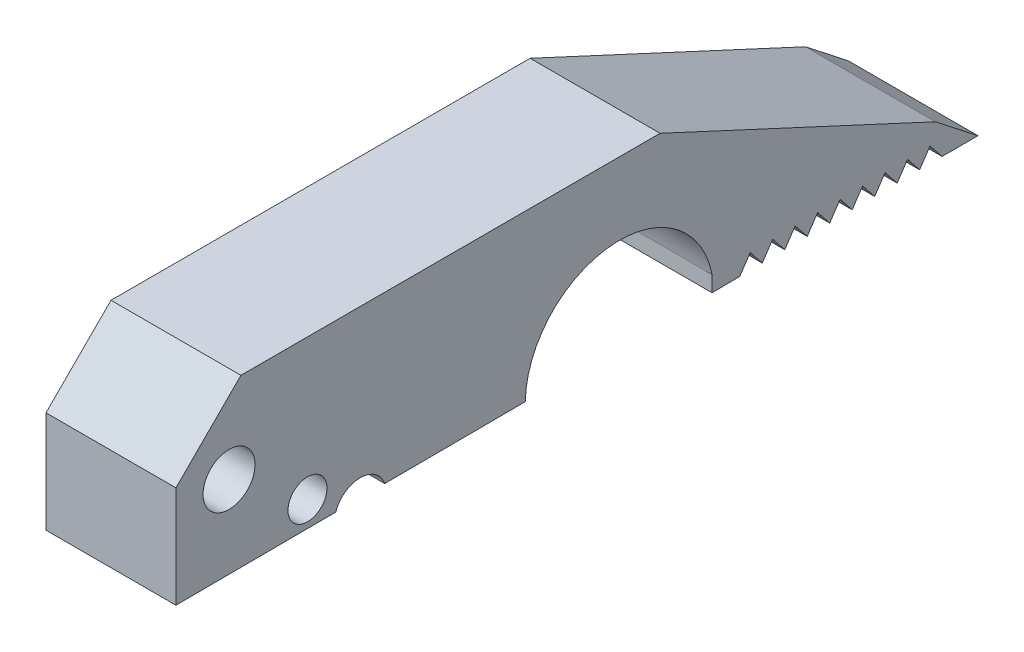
SolidWorks part; units mm, degrees
ref_plane "Front Plane" through (0, 0, 0) normal (0, 0, 1) x (1, 0, 0)
ref_plane "Top Plane" through (0, 0, 0) normal (0, 1, 0) x (1, 0, 0)
ref_plane "Right Plane" through (0, 0, 0) normal (1, 0, 0) x (0, 0, -1)
sketch "Sketch3" plane through (0, 0, 0) normal (1, 0, 0) x (0, 0, -1)
  line L4 (-10.7902, 1.4187) -> (-10.7902, 11.4187)
  line L10 (11.0435, 0) -> (11.0435, 15.403) construction
  line L11 (-10.7902, 11.4187) -> (26.4654, 11.4187)
  line L15 (47.6516, 1.5935) -> (26.4654, 11.4187)
  line L22 (-10.7902, -1.4067) -> (-10.7902, 1.4187)
  line L23 (47.6516, 1.5935) -> (50.9317, -0.9746)
  line L25 (30.4703, -1.2146) -> (30.4703, 0.0004)
  line L26 (30.4703, -1.2146) -> (32.6009, -1.1861) construction
  line L27 (30.4703, -1.2146) -> (32.6009, -1.1861)
  line L28 (32.6009, -1.1861) -> (33.403, 0.0029)
  line L29 (33.403, 0.0029) -> (34.3309, -1.163)
  line L30 (34.3309, -1.163) -> (35.133, 0.026)
  line L31 (35.133, 0.026) -> (36.0609, -1.1399)
  line L32 (36.0609, -1.1399) -> (36.863, 0.0491)
  line L33 (36.863, 0.0491) -> (37.7909, -1.1168)
  line L34 (37.7909, -1.1168) -> (38.593, 0.0722)
  line L35 (38.593, 0.0722) -> (39.5208, -1.0936)
  line L36 (39.5208, -1.0936) -> (40.3228, 0.0953)
  line L37 (40.3228, 0.0953) -> (41.2506, -1.0705)
  line L38 (41.2506, -1.0705) -> (42.0527, 0.1184)
  line L39 (42.0527, 0.1184) -> (42.9804, -1.0474)
  line L40 (42.9804, -1.0474) -> (43.7825, 0.1415)
  line L41 (43.7825, 0.1415) -> (44.7103, -1.0243)
  line L42 (44.7103, -1.0243) -> (45.5123, 0.1646)
  line L43 (45.5123, 0.1646) -> (46.4401, -1.0012)
  line L48 (47.6516, 0) -> (49.6869, 0) construction
  line L50 (48.4273, -0.9746) -> (50.9317, -0.9746)
  line L51 (48.17, -0.9781) -> (48.4273, -0.9746)
  line L52 (46.4401, -1.0012) -> (47.2422, 0.1877)
  line L53 (47.2422, 0.1877) -> (48.17, -0.9781)
  line L54 (-0.6671, 10) -> (-0.6671, -1.3596) construction
  line L55 (-10.7902, -1.4067) -> (-0.6671, -1.3553) construction
  line L56 (-10.7902, -1.4067) -> (1.5022, -1.3495)
  line L57 (30.4703, -1.1969) -> (32.6009, -1.1861) construction
  line L59 (5.2788, -1.3319) -> (16.0921, -1.2815)
  arc A3 (3.3936, 0.0005) -> (5.2788, -1.3319) centre (3.3936, -1.9995) cw
  arc A5 (16.0921, -1.2815) -> (30.4703, 0.0004) centre (23.3495, -1.4067) cw
  arc A6 (3.3936, 0.0005) -> (1.5022, -1.3495) centre (3.3936, -1.9995) ccw
  circle A7 centre (-6.7035, 4.935) radius 2
  circle A8 centre (-0.6671, 0.5933) radius 1.5
  dimension "D2" = 2
  dimension "D3" = 2
  dimension "D5" = 1.73
  dimension "D14" = 4
  dimension "D15" = 3
  dimension "D1" = 10
  dimension "D6" = 1.73
  dimension "D7" = 1.73
  dimension "D8" = 1.73
  dimension "D9" = 1.73
  dimension "D10" = 1.73
  dimension "D11" = 1.73
  dimension "D12" = 1.73
  dimension "D13" = 1.73
extrude "Boss-Extrude3" add sketch "Sketch3" along normal blind 10
ref_plane "Plane1" through (0, -1.637, 0) normal (0, 1, 0) x (1, 0, 0)
chamfer "Chamfer1" distance 5 angle 45 1 edges at (5, 11.4187, 10.7902)
